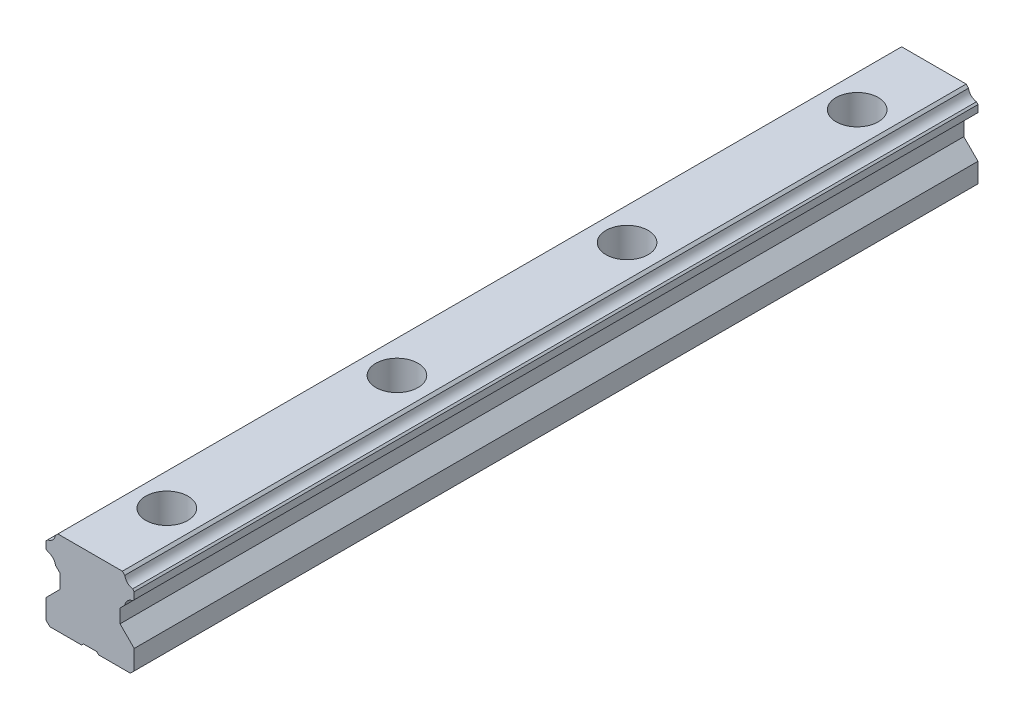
SolidWorks part; units mm, degrees
ref_plane "Front Plane" through (0, 0, 0) normal (0, 0, 1) x (1, 0, 0)
ref_plane "Top Plane" through (0, 0, 0) normal (0, 1, 0) x (1, 0, 0)
ref_plane "Right Plane" through (0, 0, 0) normal (1, 0, 0) x (0, 0, -1)
sketch "Sketch1" plane through (0, 0, 0) normal (0, 0, 1) x (1, 0, 0)
  line L0 (-9.0357, 21.3746) -> (-8.4103, 22)
  line L1 (-11.5, 18.9103) -> (-11.0794, 19.3308)
  line L2 (-11.5, 18.9103) -> (-11.5, 17.0793)
  line L3 (-11.0916, 16.6709) -> (-11.5, 17.0793)
  line L4 (-9.0337, 14.613) -> (-7.8, 13.3794)
  line L5 (-7.8, 13.3794) -> (-7.8, 9.8002)
  line L6 (-7.8, 9.8002) -> (-11.5, 6.1002)
  line L7 (-11.5, 6.1002) -> (-11.5, 1)
  line L8 (-10.5, 0) -> (-11.5, 1)
  line L9 (-10.5, 0) -> (-2.25, 0)
  line L10 (-1.75, 0.5) -> (-2.25, 0)
  line L11 (-1.75, 0.5) -> (1.75, 0.5)
  line L12 (2.25, 0) -> (1.75, 0.5)
  line L13 (2.25, 0) -> (10.5, 0)
  line L14 (11.5, 1) -> (10.5, 0)
  line L15 (11.5, 1) -> (11.5, 6.1002)
  line L16 (11.5, 6.1002) -> (7.8, 9.8002)
  line L17 (7.8, 9.8002) -> (7.8, 13.3794)
  line L18 (7.8, 13.3794) -> (9.0337, 14.613)
  line L19 (11.5, 17.0793) -> (11.0916, 16.6709)
  line L20 (11.5, 17.0793) -> (11.5, 18.9103)
  line L21 (11.0794, 19.3308) -> (11.5, 18.9103)
  line L22 (8.4103, 22) -> (9.0357, 21.3746)
  line L23 (-8.4103, 22) -> (8.4103, 22)
  arc A0 (-11.0794, 19.3308) -> (-9.0357, 21.3746) centre (-11.4827, 21.7778) ccw
  arc A1 (-9.0337, 14.613) -> (-11.0916, 16.6709) centre (-11.4827, 14.2219) ccw
  arc A2 (11.0916, 16.6709) -> (9.0337, 14.613) centre (11.4827, 14.2219) ccw
  arc A3 (9.0357, 21.3746) -> (11.0794, 19.3308) centre (11.4827, 21.7778) ccw
extrude "Boss-Extrude1" add sketch "Sketch1" along normal mid plane 220
hole_wizard "CBORE for M4 Hex Socket Head Cap Screw1" positions "Sketch2" profile "Sketch3" counterbore size "M4" standard "DIN"
sketch "Sketch2" plane through (0, 22, 0) normal (0, 1, 0) x (1, 0, 0)
  line L0 (8.4103, -110) -> (-8.4103, -110) construction
  point P0 (0, -90)
  point P2 (0, 0)
  dimension "D1" = 20
sketch "Sketch3" plane through (0, 22, 90) normal (1, 0, 0) x (0, 0, 1)
  line L0 (0, 0) -> (0, 22)
  line L1 (0, 22) -> (3.5, 22)
  line L3 (3.5, 22) -> (3.5, 9)
  line L4 (3.5, 9) -> (5.5, 9)
  line L5 (5.5, 9) -> (5.5, 0)
  line L7 (5.5, 0) -> (0, 0)
  line L11 (0, -6.35) -> (0, 107.95) construction
  dimension "Thru Hole Dia." = 7
  dimension "Thru Hole Depth" = 22
  dimension "C'Bore Dia." = 11
  dimension "C'Bore Depth" = 9
pattern_linear "LPattern1" count 4 spacing 60 along (0, 0, -1) of "CBORE for M4 Hex Socket Head Cap Screw1"
